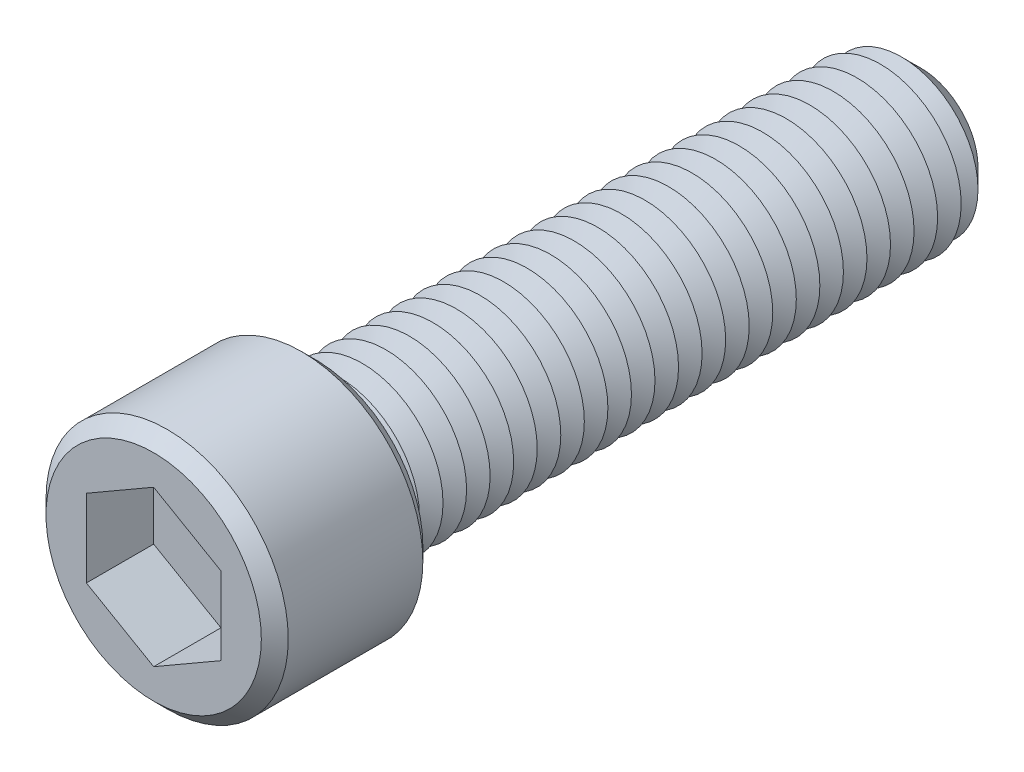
SolidWorks part; units mm, degrees
ref_plane "Front Plane" through (0, 0, 0) normal (0, 0, 1) x (1, 0, 0)
ref_plane "Top Plane" through (0, 0, 0) normal (0, 1, 0) x (1, 0, 0)
ref_plane "Right Plane" through (0, 0, 0) normal (1, 0, 0) x (0, 0, -1)
sketch "Sketch1" plane through (0, 0, 0) normal (0, 0, 1) x (1, 0, 0)
  circle A0 centre (0, 0) radius 9
  dimension "D1" = 18
extrude "Boss-Extrude1" add sketch "Sketch1" along normal blind 12
sketch "Sketch2" plane through (0, 0, 0) normal (0, 0, -1) x (-1, 0, 0)
  circle A0 centre (0, 0) radius 6
  dimension "D1" = 12
extrude "Boss-Extrude2" add sketch "Sketch2" along normal blind 45
chamfer "Chamfer1" distance 1.75 angle 45 1 edges at (-6, 0, -45)
sketch "Sketch3" plane through (0, 0, 0) normal (1, 0, 0) x (0, 0, -1)
  line L0 (-2.5121, 0) -> (4.5776, 0) construction
sketch "Sketch4" plane through (0, 0, 0) normal (1, 0, 0) x (0, 0, -1)
  line L0 (0, 6) -> (0.875, 4.4845)
  line L1 (0.875, 4.4845) -> (1.75, 6)
  line L2 (43.25, 6) -> (0, 6) construction
  line L3 (1.75, 6) -> (0, 6)
  dimension "D1" = 1.75
revolve "Cut-Revolve1" cut sketch "Sketch4" angle 360 about L0
pattern_linear "LPattern1" count 25 spacing 1.75 along (0, 0, -1) of "Cut-Revolve1"
sketch "Sketch5" plane through (0, 0, 12) normal (0, 0, 1) x (1, 0, 0)
  line L1 (0, 5.7735) -> (-5, 2.8868)
  line L2 (-5, 2.8868) -> (-5, -2.8868)
  line L3 (-5, -2.8868) -> (0, -5.7735)
  line L4 (0, -5.7735) -> (5, -2.8868)
  line L5 (5, -2.8868) -> (5, 2.8868)
  line L6 (5, 2.8868) -> (0, 5.7735)
  circle A0 centre (0, 0) radius 5 construction
  dimension "D1" = 10
extrude "Cut-Extrude1" cut sketch "Sketch5" against normal blind 5
sketch "Sketch6" plane through (0, 0, 7) normal (0, 0, 1) x (1, 0, 0)
  circle A0 centre (0, 0) radius 0.9
  dimension "D1" = 1.8
extrude "Cut-Extrude2" cut sketch "Sketch6" against normal up to surface (52 mm away)
chamfer "Chamfer2" distance 1 angle 45 2 edges at (9, 0, 0) (9, 0, 12)
